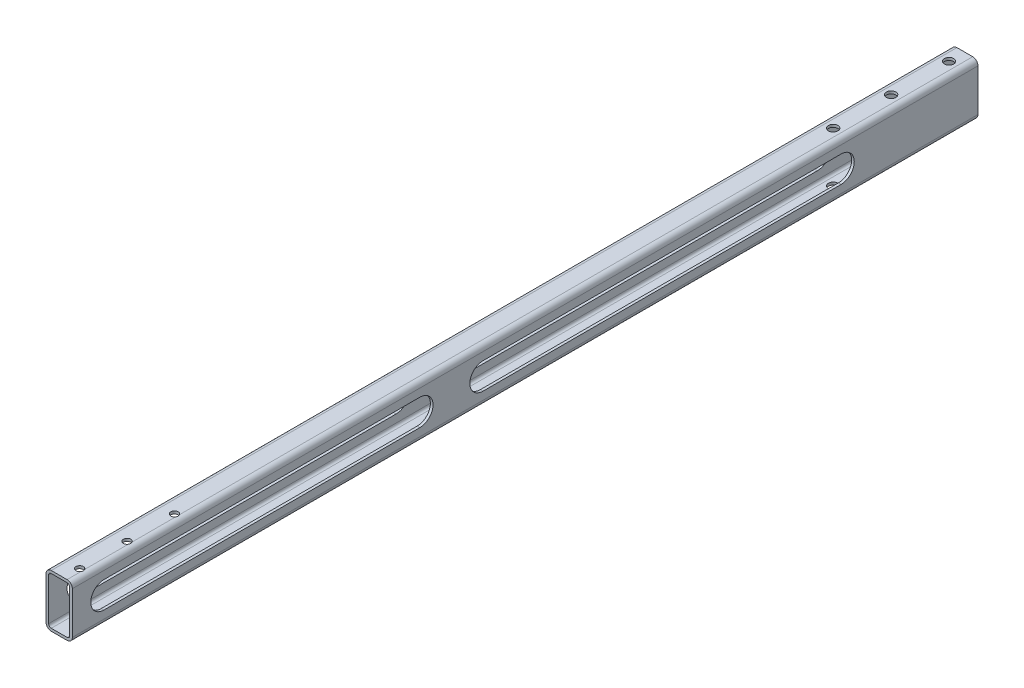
SolidWorks part; units mm, degrees
ref_plane "Face" through (0, 0, 0) normal (0, 0, 1) x (1, 0, 0)
ref_plane "Dessus" through (0, 0, 0) normal (0, 1, 0) x (1, 0, 0)
ref_plane "Droite" through (0, 0, 0) normal (1, 0, 0) x (0, 0, -1)
sketch "Esquisse1" plane through (0, 0, 0) normal (0, 0, 1) x (1, 0, 0)
  line L0 (-12.5, 20) -> (-12.5, -20)
  line L1 (-7.5, 22.5) -> (7.5, 22.5)
  line L2 (-10, 20) -> (-10, -20)
  line L3 (-7.5, -22.5) -> (7.5, -22.5)
  line L4 (10, 20) -> (10, -20)
  line L5 (-7.5, -25) -> (7.5, -25)
  line L6 (12.5, 20) -> (12.5, -20)
  line L7 (-7.5, 25) -> (7.5, 25)
  arc A0 (-10, 20) -> (-7.5, 22.5) centre (-7.5, 20) cw
  arc A1 (-7.5, -22.5) -> (-10, -20) centre (-7.5, -20) cw
  arc A2 (10, -20) -> (7.5, -22.5) centre (7.5, -20) cw
  arc A3 (7.5, 22.5) -> (10, 20) centre (7.5, 20) cw
  arc A4 (-7.5, -25) -> (-12.5, -20) centre (-7.5, -20) cw
  arc A5 (12.5, -20) -> (7.5, -25) centre (7.5, -20) cw
  arc A6 (7.5, 25) -> (12.5, 20) centre (7.5, 20) cw
  arc A7 (-12.5, 20) -> (-7.5, 25) centre (-7.5, 20) cw
  point P6 (-10, 22.5)
  point P12 (10, -22.5)
  point P15 (10, 22.5)
  dimension "D5" = 2.5
  dimension "D1" = 20
  dimension "D2" = 45
  dimension "D3" = 22.5
  dimension "D4" = 10
  dimension "D6" = 2.5
extrude "Extrusion1" add sketch "Esquisse1" along normal blind 860
sketch "Esquisse2" plane through (-12.5, 0, 0) normal (-1, 0, 0) x (0, 0, 1)
  line L0 (860, 20) -> (860, -20) construction
  line L1 (860, -20) -> (860, 20) construction
  line L2 (0, -20) -> (0, 20) construction
  line L3 (470, 12.5) -> (130, 12.5)
  line L4 (130, -12.5) -> (470, -12.5)
  line L5 (530, 12.5) -> (830, 12.5)
  line L6 (830, -12.5) -> (530, -12.5)
  line L7 (130, 0) -> (830, 0) construction
  arc A0 (130, 12.5) -> (130, -12.5) centre (130, 0) ccw
  arc A1 (470, -12.5) -> (470, 12.5) centre (470, 0) ccw
  arc A2 (530, 12.5) -> (530, -12.5) centre (530, 0) ccw
  arc A3 (830, -12.5) -> (830, 12.5) centre (830, 0) ccw
  dimension "D1" = 25
  dimension "D2" = 35
  dimension "D3" = 17.5
  dimension "D4" = 117.5
  dimension "D5" = 365
extrude "Enlèv. mat.-Extru.1" cut sketch "Esquisse2" against normal through all
sketch "Esquisse3" plane through (0, 25, 0) normal (0, 1, 0) x (-1, 0, 0)
  line L0 (0, 0) -> (0, 122.1786) construction
  line L1 (-7.5, 0) -> (7.5, 0) construction
  circle A0 centre (0, 15) radius 4.5
  circle A1 centre (0, 70) radius 4.5
  circle A2 centre (0, 125) radius 4.5
  dimension "D1" = 9
  dimension "D3" = 55
  dimension "D4" = 55
  dimension "D2" = 15
extrude "Enlèv. mat.-Extru.2" cut sketch "Esquisse3" against normal through all
sketch "Esquisse4" plane through (0, 25, 0) normal (0, 1, 0) x (-1, 0, 0)
  line L0 (-4.5, 868.8644) -> (-4.5, 741.9386) construction
  line L1 (-12.5, 860) -> (-12.5, 0) construction
  line L2 (-7.5, 860) -> (7.5, 860) construction
  circle A0 centre (-4.5, 845) radius 3.5
  circle A1 centre (-4.5, 800) radius 3.5
  circle A2 centre (-4.5, 755) radius 3.5
  dimension "D2" = 7
  dimension "D3" = 15
  dimension "D4" = 45
  dimension "D5" = 45
  dimension "D1" = 8
extrude "Enlèv. mat.-Extru.3" cut sketch "Esquisse4" against normal through all
